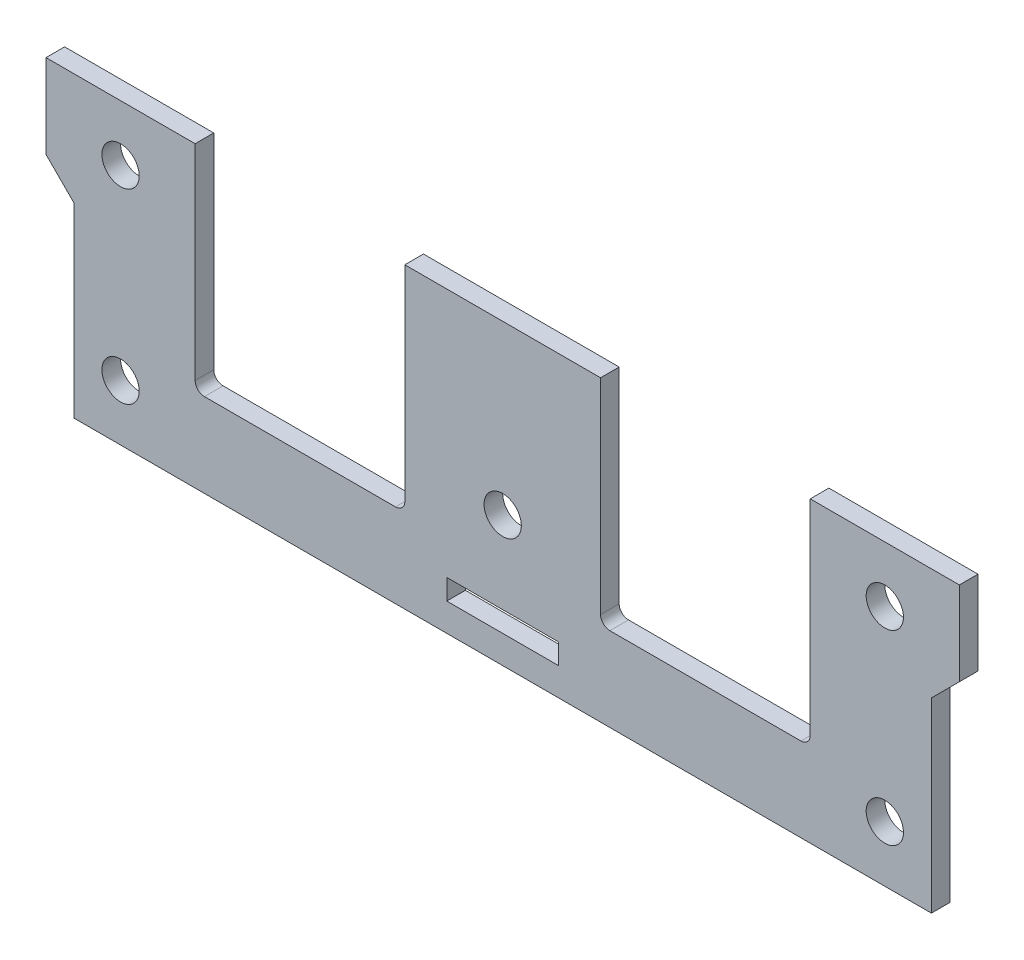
SolidWorks part; units mm, degrees
ref_plane "Plan de face" through (0, 0, 0) normal (0, 0, 1) x (1, 0, 0)
ref_plane "Plan de dessus" through (0, 0, 0) normal (0, 1, 0) x (1, 0, 0)
ref_plane "Plan de droite" through (0, 0, 0) normal (1, 0, 0) x (0, 0, -1)
sketch "Esquisse1" plane through (0, 0, 0) normal (0, 0, 1) x (1, 0, 0)
  line L0 (0, 0) -> (0, 54.4159) construction
  line L1 (-24, 0) -> (24, 0)
  line L2 (-24.5, 0.5) -> (-24.5, 16)
  line L3 (-24.5, 16) -> (-16.5, 16)
  line L4 (24.5, 0.5) -> (24.5, 16)
  line L5 (-5.25, 16) -> (5.25, 16)
  line L6 (-16.5, 16) -> (-16.5, 5)
  line L7 (-16, 4.5) -> (-5.75, 4.5)
  line L8 (-5.25, 16) -> (-5.25, 5)
  line L9 (16.5, 16) -> (24.5, 16)
  line L10 (5.25, 16) -> (5.25, 5)
  line L11 (5.75, 4.5) -> (16, 4.5)
  line L12 (16.5, 16) -> (16.5, 5)
  line L14 (-3, 2.6) -> (3, 2.6)
  line L15 (-3, 2.6) -> (-3, 1.5)
  line L16 (-3, 1.5) -> (3, 1.5)
  line L17 (3, 2.6) -> (3, 1.5)
  arc A0 (24, 0) -> (24.5, 0.5) centre (24, 0.5) ccw
  arc A1 (16, 4.5) -> (16.5, 5) centre (16, 5) ccw
  arc A2 (5.25, 5) -> (5.75, 4.5) centre (5.75, 5) ccw
  arc A3 (-5.75, 4.5) -> (-5.25, 5) centre (-5.75, 5) ccw
  arc A4 (-16.5, 5) -> (-16, 4.5) centre (-16, 5) ccw
  arc A5 (-24, 0) -> (-24.5, 0.5) centre (-24, 0.5) cw
  circle A6 centre (20.5, 3) radius 1
  circle A7 centre (20.5, 13) radius 1
  circle A8 centre (0, 7) radius 1
  circle A9 centre (-20.5, 13) radius 1
  circle A10 centre (-20.5, 3) radius 1
  point P17 (24.5, 0)
  point P28 (-24.5, 0)
  dimension "D6" = 0.5
  dimension "D7" = 2
  dimension "D1" = 49
  dimension "D2" = 10.5
  dimension "D3" = 8
  dimension "D4" = 4.5
  dimension "D5" = 16
  dimension "D8" = 3
  dimension "D9" = 4
  dimension "D10" = 3
  dimension "D11" = 4
  dimension "D12" = 7
  dimension "D13" = 6
  dimension "D14" = 1.1
  dimension "D15" = 1.5
extrude "Extrusion1" add sketch "Esquisse1" along normal blind 1
sketch "Esquisse3" plane through (0, 0, 1) normal (0, 0, 1) x (1, 0, 0)
  line L0 (0, 0) -> (0, 11.6415) construction
  line L1 (-24, 0) -> (24, 0) construction
  line L2 (-23, 0) -> (-24.5, 0)
  line L3 (-23, 0) -> (-23, 11.5)
  line L4 (-23, 11.5) -> (-24.5, 11.5)
  line L5 (-24.5, 0) -> (-24.5, 11.5)
  line L6 (-24.5, 16) -> (-24.5, 0.5) construction
  line L7 (24.5, 0) -> (24.5, 11.5)
  line L8 (23, 11.5) -> (24.5, 11.5)
  line L9 (23, 0) -> (23, 11.5)
  line L10 (23, 0) -> (24.5, 0)
  dimension "D1" = 1.5
  dimension "D2" = 11.5
extrude "Enlèv. mat.-Extru.1" cut sketch "Esquisse3" against normal through all
chamfer "Chanfrein1" distance 1.5 angle 45 6 edges at (23.75, 11.5, 1) (23.75, 11.5, 0) (23, 11.5, 0.5) (-23.75, 11.5, 1) (-23, 11.5, 0.5) (-23.75, 11.5, 0)
